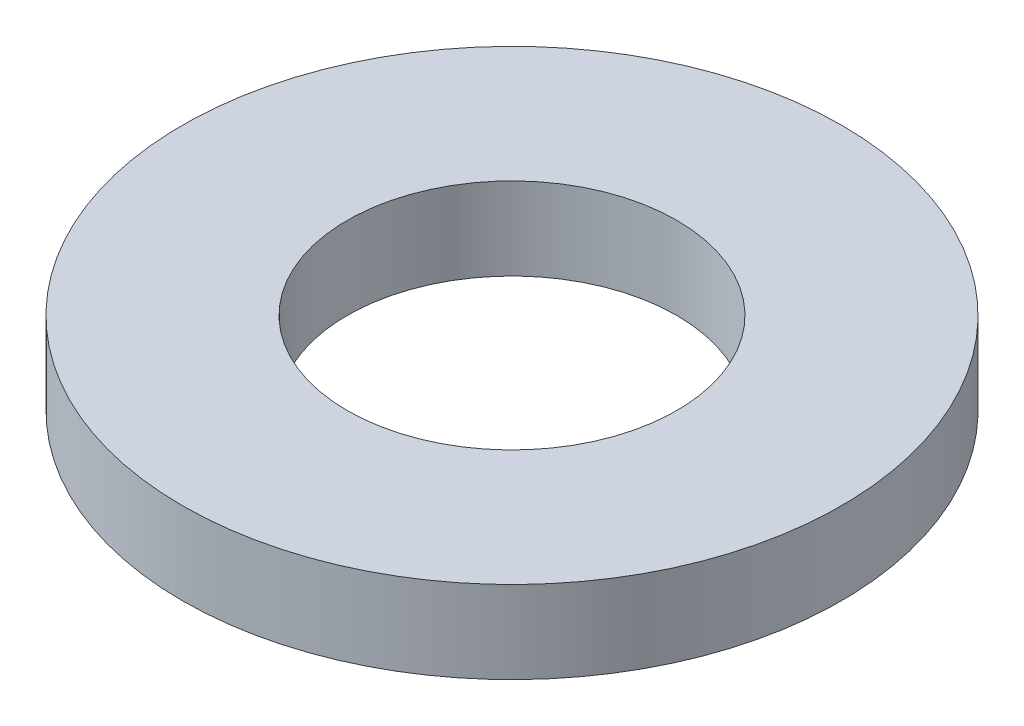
SolidWorks part; units mm, degrees
ref_plane "Front Plane" through (0, 0, 0) normal (0, 0, 1) x (1, 0, 0)
ref_plane "Top Plane" through (0, 0, 0) normal (0, 1, 0) x (1, 0, 0)
ref_plane "Right Plane" through (0, 0, 0) normal (1, 0, 0) x (0, 0, -1)
sketch "Sketch1" plane through (0, 0, 0) normal (0, 1, 0) x (1, 0, 0)
  circle A0 centre (0, 0) radius 1
  circle A1 centre (0, 0) radius 2
  dimension "D1" = 2
  dimension "D2" = 4
extrude "Boss-Extrude1" add sketch "Sketch1" along normal blind 0.5
